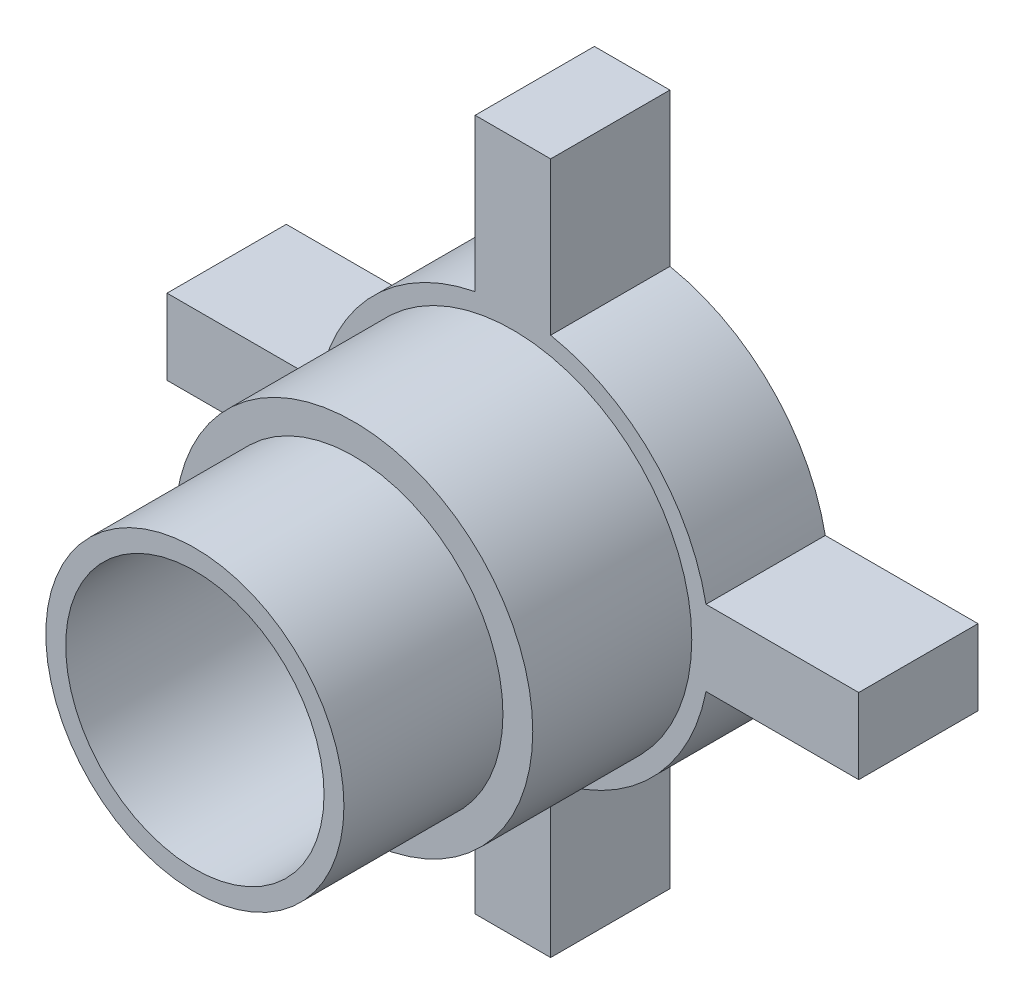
SolidWorks part; units mm, degrees
ref_plane "前视基准面" through (0, 0, 0) normal (0, 0, 1) x (1, 0, 0)
ref_plane "上视基准面" through (0, 0, 0) normal (0, 1, 0) x (1, 0, 0)
ref_plane "右视基准面" through (0, 0, 0) normal (1, 0, 0) x (0, 0, -1)
other "Configuration Table"
sketch "草图1" plane through (0, 0, 0) normal (0, 0, 1) x (1, 0, 0)
  line L0 (-1.9, 9.716) -> (-1.9, 17.4)
  line L1 (-1.9, -17.4) -> (1.9, -17.4)
  line L2 (-1.9, -17.4) -> (-1.9, -9.716)
  line L3 (-1.9, 17.4) -> (1.9, 17.4)
  line L4 (1.9, -17.4) -> (1.9, -9.716)
  line L7 (-17.4, 1.9) -> (-9.716, 1.9)
  line L8 (-17.4, 1.9) -> (-17.4, -1.9)
  line L9 (-17.4, -1.9) -> (-9.716, -1.9)
  line L10 (17.4, 1.9) -> (17.4, -1.9)
  line L15 (1.9, 9.716) -> (1.9, 17.4)
  line L16 (9.716, 1.9) -> (17.4, 1.9)
  line L19 (9.716, -1.9) -> (17.4, -1.9)
  arc A0 (-9.716, -1.9) -> (-1.9, -9.716) centre (0, 0) ccw
  arc A1 (-1.9, 9.716) -> (-9.716, 1.9) centre (0, 0) ccw
  arc A2 (9.716, 1.9) -> (1.9, 9.716) centre (0, 0) ccw
  arc A3 (1.9, -9.716) -> (9.716, -1.9) centre (0, 0) ccw
  dimension "D1" = 19.8
  dimension "D2" = 3.8
  dimension "D3" = 34.8
  dimension "D4" = 34.8
  dimension "D5" = 3.8
extrude "凸台-拉伸1" add sketch "草图1" along normal blind 6
sketch "草图2" plane through (0, 0, 6) normal (0, 0, 1) x (1, 0, 0)
  circle A0 centre (0, 0) radius 9
  dimension "D1" = 18
extrude "凸台-拉伸2" add sketch "草图2" along normal blind 8
sketch "草图3" plane through (0, 0, 14) normal (0, 0, 1) x (1, 0, 0)
  circle A0 centre (0, 0) radius 7.5
  dimension "D1" = 15
extrude "凸台-拉伸3" add sketch "草图3" along normal blind 8
sketch "草图4" plane through (0, 0, 22) normal (0, 0, 1) x (1, 0, 0)
  circle A0 centre (0, 0) radius 6.5
  dimension "D1" = 13
extrude "切除-拉伸1" cut sketch "草图4" against normal through all
